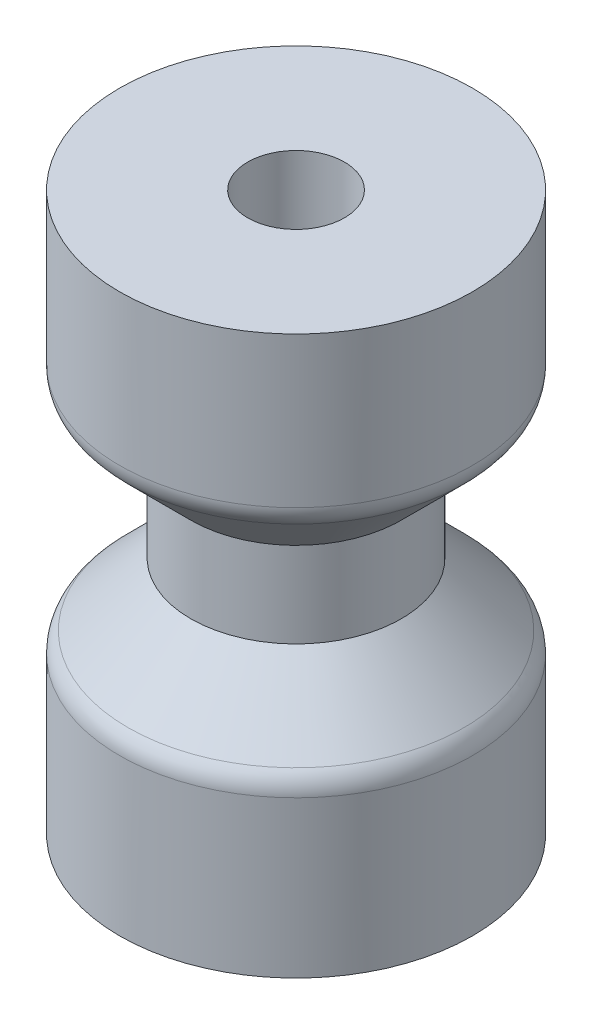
SolidWorks part; units mm, degrees
ref_plane "前视基准面" through (0, 0, 0) normal (0, 0, 1) x (1, 0, 0)
ref_plane "上视基准面" through (0, 0, 0) normal (0, 1, 0) x (1, 0, 0)
ref_plane "右视基准面" through (0, 0, 0) normal (1, 0, 0) x (0, 0, -1)
sketch "草图1" plane through (0, 0, 0) normal (0, 1, 0) x (1, 0, 0)
  circle A0 centre (0, 0) radius 6.2
  circle A1 centre (0, 0) radius 1.7
  dimension "D1" = 12.4
  dimension "D2" = 3.4
extrude "凸台-拉伸1" add sketch "草图1" along normal blind 19.6
ref_axis "基准轴1" through (0, 33.0805, 0) along (0, -1, 0)
sketch "草图4" plane through (0, 0, 0) normal (1, 0, 0) x (0, 0, -1)
  line L0 (-6.2, 19.6) -> (-6.2, 0) construction
  line L1 (-6.2, 13.9) -> (-6.2, 5.9)
  line L2 (-14.8524, 9.9) -> (22.5653, 9.9) construction
  line L3 (-6.2, 13.9) -> (-3.7, 11.4)
  line L4 (-3.7, 11.4) -> (-3.7, 8.4)
  line L5 (-3.7, 8.4) -> (-6.2, 5.9)
  dimension "D1" = 3
  dimension "D2" = 2.5
  dimension "D3" = 1.5
  dimension "D4" = 45
  dimension "D5" = 45
  dimension "D6" = 8
revolve "切除-旋转1" cut sketch "草图4" angle 360 about axis through (0, 33.0805, 0) along (0, -1, 0)
fillet "圆角1" radius 1 2 edges at (0, 5.9, 6.2) (0, 13.9, 6.2)
